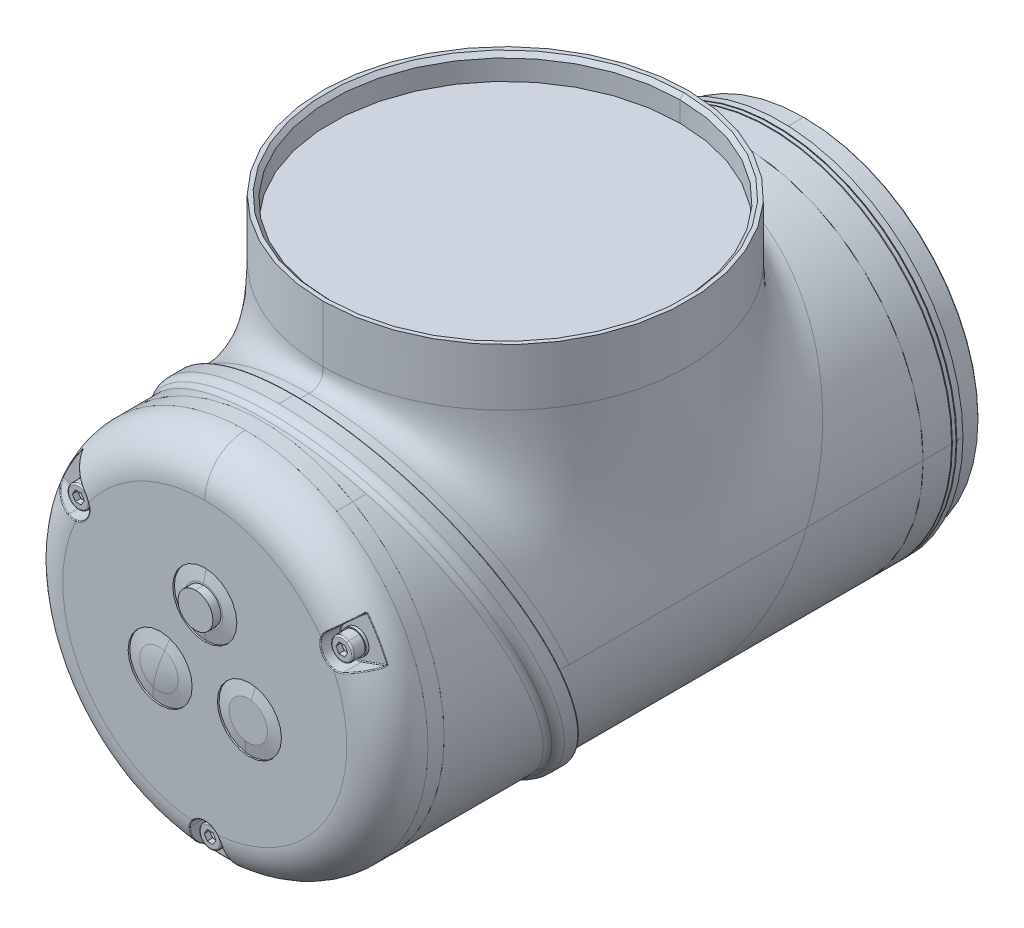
SolidWorks part; units mm, degrees
ref_plane "前视基准面" through (0, 0, 0) normal (0, 0, 1) x (1, 0, 0)
ref_plane "上视基准面" through (0, 0, 0) normal (0, 1, 0) x (1, 0, 0)
ref_plane "右视基准面" through (0, 0, 0) normal (1, 0, 0) x (0, 0, -1)
imported_body "输入1"
imported_body "输入2"
ref_plane "基准面1" through (0, 0, -58) normal (0, 0, -1) x (-1, 0, 0)
ref_plane "基准面2" through (0, 0, -65) normal (0, 0, -1) x (-1, 0, 0)
ref_plane "基准面3" through (0, -11.6142, 27.3614) normal (0, 0.3907, -0.9205) x (-1, 0, 0)
split "分割1" trim tools "基准面3", "基准面1", "基准面2" bodies to split 108 resulting bodies 109 110 111 112
ref_plane "基准面4" through (0, 0, 64.0927) normal (0, 0, 1) x (1, 0, 0)
ref_plane "基准面5" through (0, 0, 60.0927) normal (0, 0, 1) x (1, 0, 0)
split "分割2" trim tools "基准面4", "基准面5" bodies to split 112 resulting bodies 113 114 115
